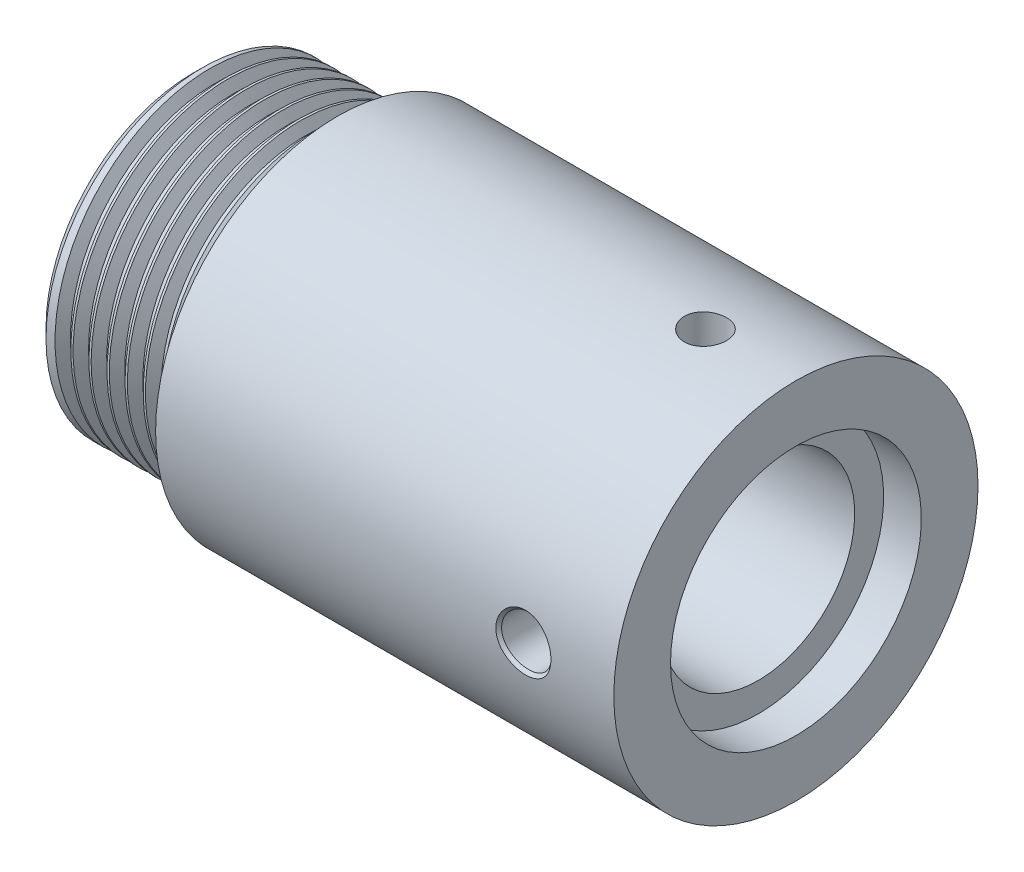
SolidWorks part; units mm, degrees
ref_plane "Front Plane" through (0, 0, 0) normal (0, 0, 1) x (1, 0, 0)
ref_plane "Top Plane" through (0, 0, 0) normal (0, 1, 0) x (1, 0, 0)
ref_plane "Right Plane" through (0, 0, 0) normal (1, 0, 0) x (0, 0, -1)
ref_plane "Plan1" through (0, 0, 0) normal (0, 0, -1) x (-1, 0, 0)
sketch "Esquisse1" plane through (0, 0, 0) normal (0, 0, -1) x (-1, 0, 0)
  line L0 (-50, 15.1) -> (-50, 0)
  line L1 (-50, 0) -> (-12, 0)
  line L2 (-12, 0) -> (-12, 15.1)
  line L3 (-12, 15.1) -> (-50, 15.1)
  line L4 (-50, 0) -> (-12, 0) construction
revolve "Révolution1" add sketch "Esquisse1" angle 360 about L4
sketch "Esquisse2" plane through (12, 0, 0) normal (-1, 0, 0) x (0, 0, 1)
  circle A0 centre (0, 0) radius 12.1881
extrude "Boss.-Extru.1" add sketch "Esquisse2" along normal blind 1.2
sketch "Esquisse3" plane through (10.8, 0, 0) normal (-1, 0, 0) x (0, 0, 1)
  circle A0 centre (0, 0) radius 12.1881
extrude "Boss.-Extru.2" add sketch "Esquisse3" along normal blind 0.8119 draft 45
sketch "Esquisse4" plane through (9.9881, 0, 0) normal (-1, 0, 0) x (0, 0, 1)
  circle A0 centre (0, 0) radius 13
extrude "Boss.-Extru.3" add sketch "Esquisse4" along normal blind 9.9881
sketch "Esquisse5" plane through (0, 0, 0) normal (0, 0, -1) x (-1, 0, 0)
  line L0 (-50, 10.4) -> (-50, 0)
  line L1 (-50, 0) -> (0, 0)
  line L2 (0, 0) -> (0, 10.4)
  line L3 (0, 10.4) -> (-3.125, 10.4)
  line L4 (-3.125, 10.4) -> (-3.125, 8)
  line L5 (-3.125, 8) -> (-46.875, 8)
  line L6 (-46.875, 8) -> (-46.875, 10.4)
  line L7 (-46.875, 10.4) -> (-50, 10.4)
  line L8 (-50, 0) -> (0, 0) construction
revolve "Enlèvement de matière-Révolution1" cut sketch "Esquisse5" angle 360 about L8
hole_wizard "Diamètre du perçage Ø3.5 (3.5)1" positions "Esquisse3D1" profile "Esquisse6" hole size "Ø3.5" standard "Ansi Metric"
sketch3d "Esquisse3D1"
  point P0 (42.5, 15.1, 0)
sketch "Esquisse6" plane through (42.5, 15.1, 0) normal (1, 0, 0) x (0, 0, 1)
  line L0 (0, 0) -> (0, 4.5104)
  line L1 (0, 4.5104) -> (1.75, 3.5)
  line L2 (1.75, 3.5) -> (1.75, 0)
  line L5 (1.75, 0) -> (0, 0)
  line L10 (0, 4.5104) -> (-1.75, 3.5) construction
  line L11 (0, -6.35) -> (0, 107.95) construction
  dimension "Diamètre du perçage" = 3.5
  dimension "Profondeur du perçage" = 3.5
  dimension "Angle de pointe" = 120
hole_wizard "Dégagement M3.51" positions "Esquisse3D2" profile "Esquisse7" hole size "M3.5" standard "Ansi Metric"
sketch3d "Esquisse3D2"
  point P0 (42.5, 0, 15.1)
sketch "Esquisse7" plane through (42.5, 0, 15.1) normal (1, 0, 0) x (0, -1, 0)
  line L0 (0, 0) -> (0, 7.1)
  line L1 (0, 7.1) -> (2.067, 7.1)
  line L2 (2.067, 7.1) -> (2.067, 0)
  line L5 (2.067, 0) -> (0, 0)
  line L11 (0, -6.35) -> (0, 107.95) construction
  dimension "Diamètre du perçage jusqu'au prochain" = 4.134
  dimension "Profondeur du perçage jusqu'au prochain" = 7.1
chamfer "Chanfrein1" distance 0.8119 angle 45 1 edges at (0, 0, 13)
chamfer "Chanfrein2" distance 0.2931 angle 45 1 edges at (40.4834, -0.4537, 15.0932)
thread "Filetage2" pitch 1.5 start angle 0, offset 0, length 0, pitch 1.5, diameter 26
ref_plane "Plan3" through (0.8119, 0, -13) normal (0, -1, 0) x (0, 0, -1)
sketch "Profil de filetage2" plane through (0.8119, 0, -13) normal (0, -1, 0) x (0, 0, -1)
  line L0 (0, 0) -> (0, 1.5) construction
  line L11 (0, 0) -> (0, 1.3125)
  line L12 (0, 1.3125) -> (-0.8119, 0.8437)
  line L13 (-0.8119, 0.8437) -> (-0.8119, 0.4687)
  line L15 (-0.8119, 0.4687) -> (0, 0)
  line L17 (-0.8119, 0.6562) -> (0, 0.6562) construction
  point P2 (0, 0)
  dimension "Pitch" = 1.5
  dimension "Profile_Angle" = 60
  dimension "Profile_Land" = 0.375
  dimension "Profile_Height" = 0.8119
